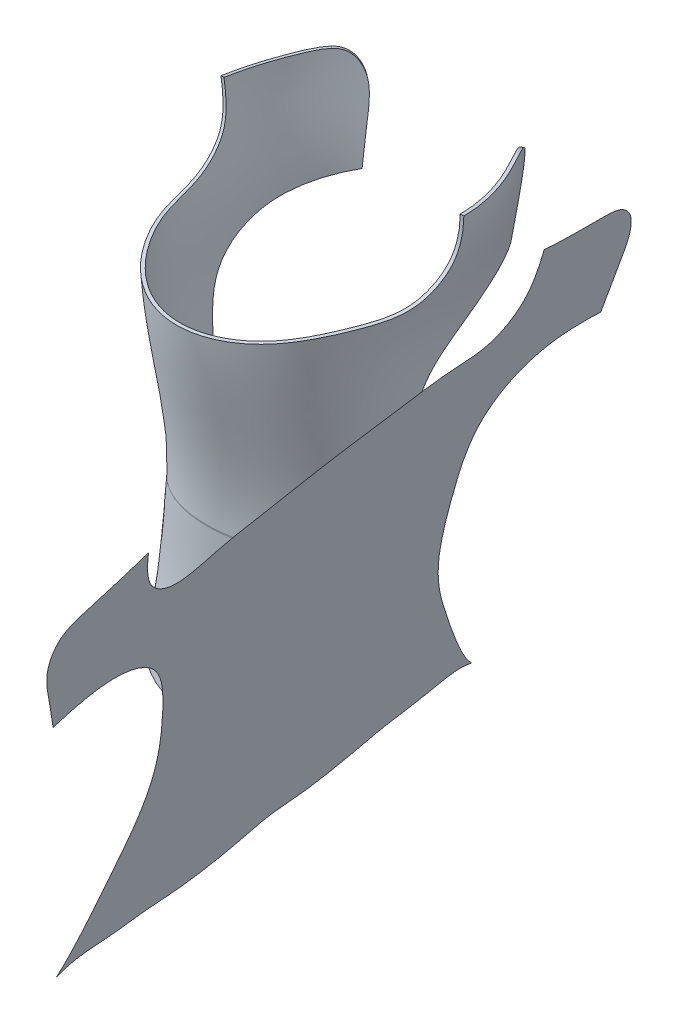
SolidWorks part; units mm, degrees
ref_plane "Front Plane" through (0, 0, 0) normal (0, 0, 1) x (1, 0, 0)
ref_plane "Top Plane" through (0, 0, 0) normal (0, 1, 0) x (1, 0, 0)
ref_plane "Right Plane" through (0, 0, 0) normal (1, 0, 0) x (0, 0, -1)
imported_body "Imported1"
surface "Surface-Flatten1"
